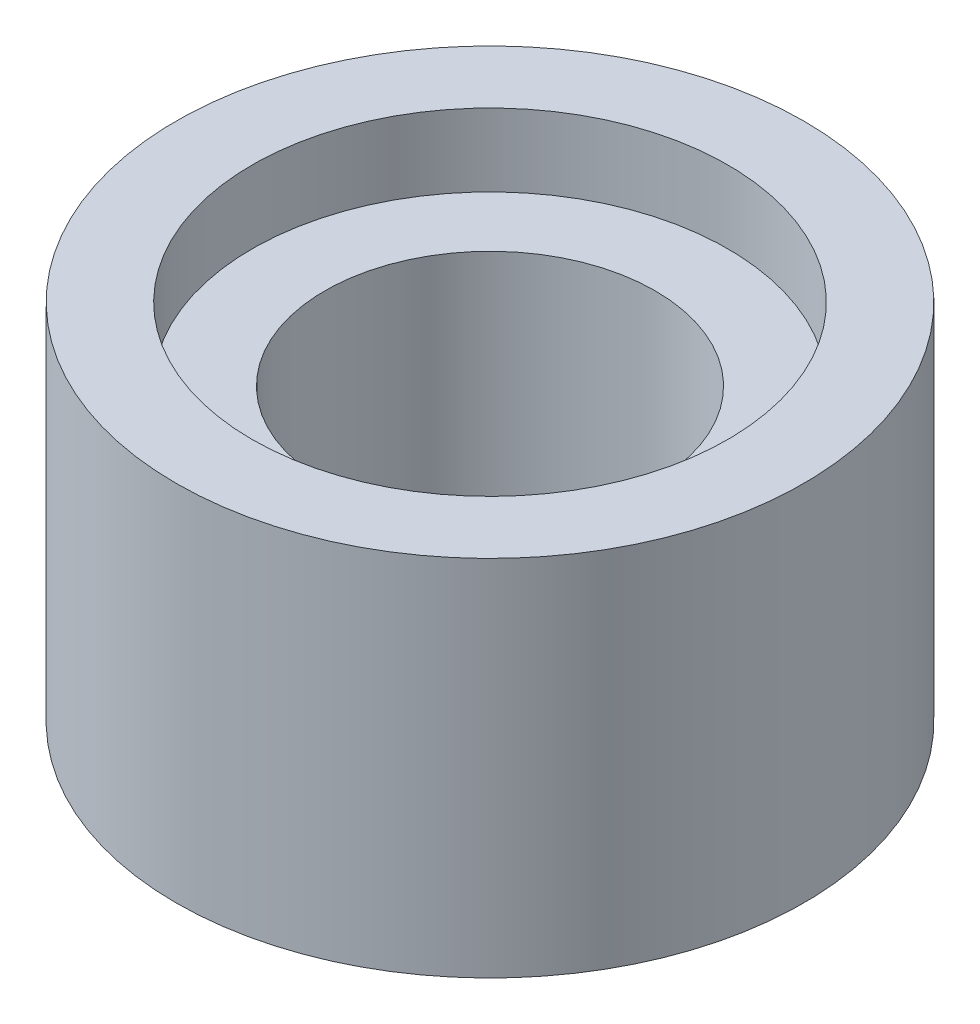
SolidWorks part; units mm, degrees
ref_plane "Plan1" through (0, 0, 0) normal (0, 0, 1) x (1, 0, 0)
ref_plane "Plan2" through (0, 0, 0) normal (0, 1, 0) x (1, 0, 0)
ref_plane "Plan3" through (0, 0, 0) normal (1, 0, 0) x (0, 0, -1)
sketch "Esquisse1" plane through (0, 0, 0) normal (1, 0, 0) x (0, -1, 0)
  line L0 (0, 7.3341) -> (0, 9.6341)
  line L1 (0, 9.6341) -> (11, 9.6341)
  line L2 (11, 9.6341) -> (11, 7.3341)
  line L8 (-12.5747, 0.1341) -> (48.4041, 0.1341) construction
  line L9 (0, 7.3341) -> (2.2, 7.3341)
  line L10 (2.2, 7.3341) -> (2.2, 5.1341)
  line L11 (2.2, 5.1341) -> (8.8, 5.1341)
  line L12 (8.8, 5.1341) -> (8.8, 7.3341)
  line L13 (8.8, 7.3341) -> (11, 7.3341)
  dimension "D1" = 7.2
  dimension "D2" = 2.2
  dimension "D3" = 2.2
  dimension "D4" = 11
  dimension "D5" = 9.5
  dimension "D6" = 5
revolve "Base-Révolution" add sketch "Esquisse1" angle 360 about L8
